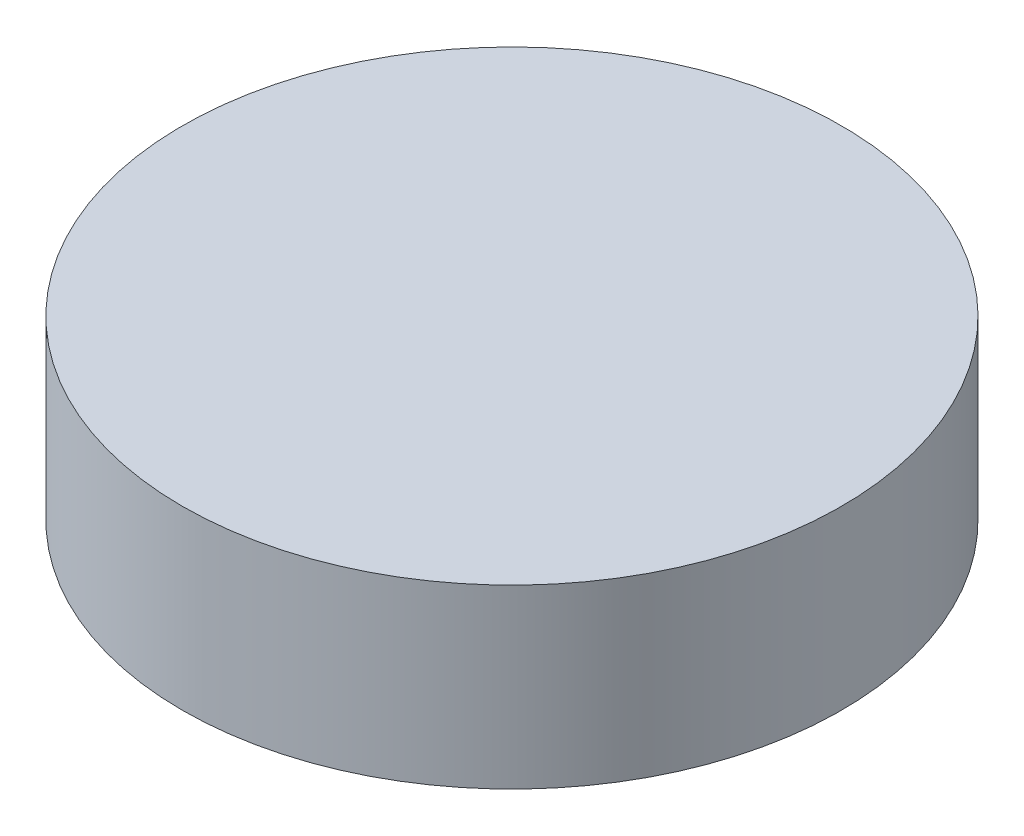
SolidWorks part; units mm, degrees
ref_plane "Front Plane" through (0, 0, 0) normal (0, 0, 1) x (1, 0, 0)
ref_plane "Top Plane" through (0, 0, 0) normal (0, 1, 0) x (1, 0, 0)
ref_plane "Right Plane" through (0, 0, 0) normal (1, 0, 0) x (0, 0, -1)
sketch "Sketch1" plane through (0, 0, 0) normal (0, 1, 0) x (1, 0, 0)
  circle A0 centre (0, 0) radius 3.175
extrude "Boss-Extrude1" add sketch "Sketch1" along normal blind 1.7018
